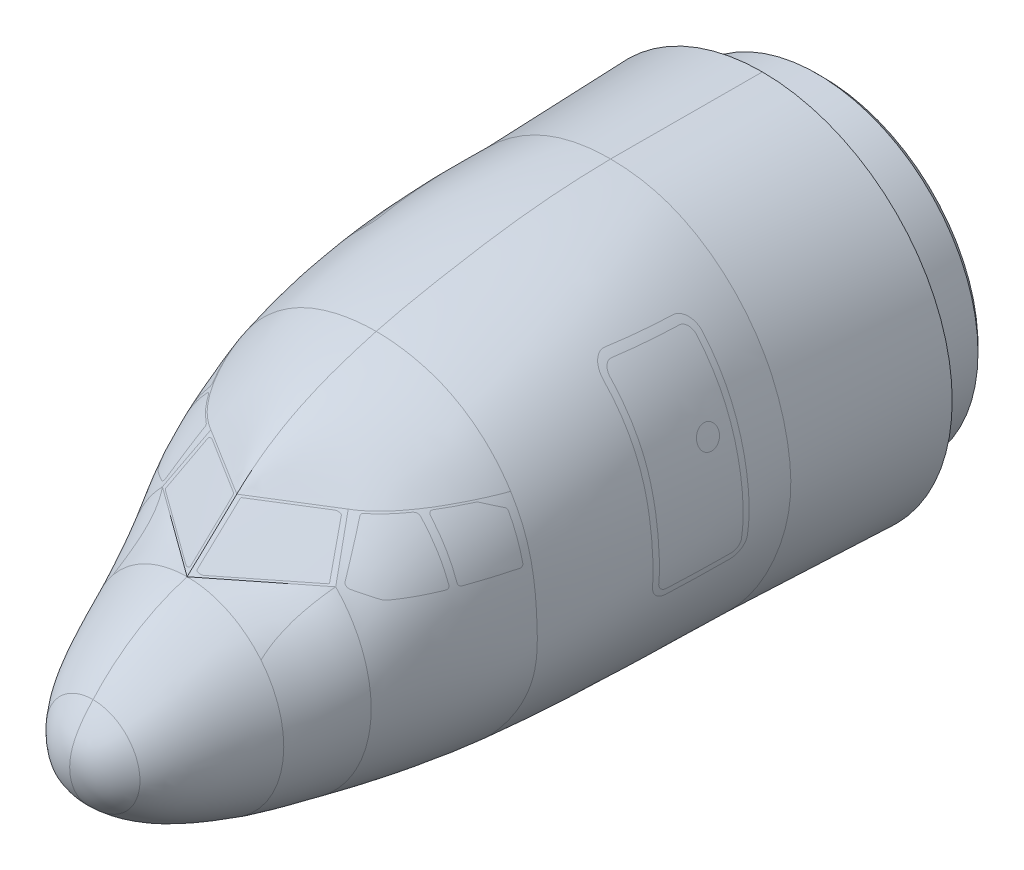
SolidWorks part; units mm, degrees
ref_plane "Plan de face" through (0, 0, 0) normal (0, 0, 1) x (1, 0, 0)
ref_plane "Plan de dessus" through (0, 0, 0) normal (0, 1, 0) x (1, 0, 0)
ref_plane "Plan de droite" through (0, 0, 0) normal (1, 0, 0) x (0, 0, -1)
imported_body "Importée1"
scale "Echelle1"
ref_plane "Plan1" through (0, 0, -45.625) normal (0, 0, -1) x (-1, 0, 0)
sketch "Esquisse1" plane through (0, 0, -35.625) normal (0, 0, -1) x (-1, 0, 0)
  spline S2 degree 3 poles (-627.1798, 2924.8183) (-59.9591, 38.7146) (-23.2962, -13.9617) (2.7538, -7.8013) (3.1383, -7.6959) (3.9006, -7.45) (4.2762, -7.3101) (5.366, -6.8333) (6.0457, -6.4313) (6.9995, -5.7104) (7.3075, -5.4498) (7.8894, -4.904) (8.1652, -4.6176) (8.6889, -4.0198) (8.9368, -3.7085) (9.4061, -3.0622) (9.6278, -2.7265) (10.2451, -1.7017) (10.5977, -0.9899) (11.1976, 0.4844) (11.4467, 1.2518) (11.7873, 2.8007) (11.8783, 3.5874) (11.8689, 4.7896) (11.8434, 5.1913) (11.7557, 5.9839) (11.6933, 6.3768) (11.5372, 7.157) (11.4434, 7.5443) (11.2224, 8.3127) (11.0948, 8.6948) (10.6669, 9.8116) (10.319, 10.5228) (9.6977, 11.5366) (9.4742, 11.8658) (8.9934, 12.5062) (8.7367, 12.8162) (7.9323, 13.6982) (7.346, 14.2298) (6.3883, 14.9391) (6.0551, 15.1612) (5.3639, 15.5712) (5.011, 15.7561) (3.9296, 16.2494) (3.1776, 16.4936) (2.0026, 16.7317) (1.6027, 16.7903) (-55.1553, 22.2186) (-141.8735, -367.5838) (61.0488, 3012.8504) knots -2.009397 -2.009397 -2.009397 -2.009397 0.0625 0.0625 0.09375 0.09375 0.125 0.125 0.1875 0.1875 0.21875 0.21875 0.25 0.25 0.28125 0.28125 0.3125 0.3125 0.375 0.375 0.4375 0.4375 0.5 0.5 0.53125 0.53125 0.5625 0.5625 0.59375 0.59375 0.625 0.625 0.6875 0.6875 0.71875 0.71875 0.75 0.75 0.8125 0.8125 0.84375 0.84375 0.875 0.875 0.9375 0.9375 0.96875 0.96875 5.376639 5.376639 5.376639 5.376639 only from (0, -8.2055) to (0, 16.885)
  spline S3 degree 3 poles (-301.0809, 2998.3208) (177.8937, -393.4364) (53.5442, 27.8643) (-2.7603, 16.579) (-3.1459, 16.4799) (-3.9094, 16.2338) (-4.2836, 16.0877) (-5.3686, 15.5935) (-6.0501, 15.1881) (-7.0149, 14.4757) (-7.3264, 14.2205) (-7.9175, 13.6862) (-8.1988, 13.4058) (-8.734, 12.8192) (-8.9878, 12.5131) (-9.4678, 11.8749) (-9.6944, 11.5418) (-10.3196, 10.5223) (-10.6673, 9.8102) (-11.236, 8.3266) (-11.4582, 7.5505) (-11.7703, 5.9939) (-11.8639, 5.2081) (-11.8758, 4.0139) (-11.8565, 3.6101) (-11.7696, 2.8138) (-11.7036, 2.4214) (-11.4488, 1.259) (-11.2044, 0.5032) (-10.7532, -0.6088) (-10.5885, -0.9748) (-10.2337, -1.6881) (-10.043, -2.0366) (-9.6339, -2.7169) (-9.4154, -3.0485) (-8.9483, -3.6935) (-8.6987, -4.0081) (-7.9075, -4.9129) (-7.3302, -5.4587) (-6.3798, -6.1797) (-6.0475, -6.4043) (-5.3556, -6.8129) (-5.0003, -6.9934) (-3.9093, -7.4704) (-3.1502, -7.7073) (23.8326, -14.0951) (58.4146, 42.4045) (465.7415, 2954.7742) knots -4.430432 -4.430432 -4.430432 -4.430432 0.0625 0.0625 0.09375 0.09375 0.125 0.125 0.1875 0.1875 0.21875 0.21875 0.25 0.25 0.28125 0.28125 0.3125 0.3125 0.375 0.375 0.4375 0.4375 0.5 0.5 0.53125 0.53125 0.5625 0.5625 0.625 0.625 0.65625 0.65625 0.6875 0.6875 0.71875 0.71875 0.75 0.75 0.8125 0.8125 0.84375 0.84375 0.875 0.875 0.9375 0.9375 3.038245 3.038245 3.038245 3.038245 only from (0, 16.885) to (0, -8.2055)
  spline S4 degree 3 poles (0, -8.2055) (0.8084, -8.2055) (1.5926, -8.0759) (2.7538, -7.8013) (3.1383, -7.6959) (3.9006, -7.45) (4.2762, -7.3101) (5.366, -6.8333) (6.0457, -6.4313) (6.9995, -5.7104) (7.3075, -5.4498) (7.8894, -4.904) (8.1652, -4.6176) (8.6889, -4.0198) (8.9368, -3.7085) (9.4061, -3.0622) (9.6278, -2.7265) (10.2451, -1.7017) (10.5977, -0.9899) (11.1976, 0.4844) (11.4467, 1.2518) (11.7873, 2.8007) (11.8783, 3.5874) (11.8689, 4.7896) (11.8434, 5.1913) (11.7557, 5.9839) (11.6933, 6.3768) (11.5372, 7.157) (11.4434, 7.5443) (11.2224, 8.3127) (11.0948, 8.6948) (10.6669, 9.8116) (10.319, 10.5228) (9.6977, 11.5366) (9.4742, 11.8658) (8.9934, 12.5062) (8.7367, 12.8162) (7.9323, 13.6982) (7.346, 14.2298) (6.3883, 14.9391) (6.0551, 15.1612) (5.3639, 15.5712) (5.011, 15.7561) (3.9296, 16.2494) (3.1776, 16.4936) (2.0026, 16.7317) (1.6027, 16.7903) (0.8036, 16.8667) (0.4025, 16.885) (0, 16.885) knots 0 0 0 0 0.0625 0.0625 0.09375 0.09375 0.125 0.125 0.1875 0.1875 0.21875 0.21875 0.25 0.25 0.28125 0.28125 0.3125 0.3125 0.375 0.375 0.4375 0.4375 0.5 0.5 0.53125 0.53125 0.5625 0.5625 0.59375 0.59375 0.625 0.625 0.6875 0.6875 0.71875 0.71875 0.75 0.75 0.8125 0.8125 0.84375 0.84375 0.875 0.875 0.9375 0.9375 0.96875 0.96875 1 1 1 1
  spline S5 degree 3 poles (0, 16.885) (-0.8025, 16.8851) (-1.5936, 16.8129) (-2.7603, 16.579) (-3.1459, 16.4799) (-3.9094, 16.2338) (-4.2836, 16.0877) (-5.3686, 15.5935) (-6.0501, 15.1881) (-7.0149, 14.4757) (-7.3264, 14.2205) (-7.9175, 13.6862) (-8.1988, 13.4058) (-8.734, 12.8192) (-8.9878, 12.5131) (-9.4678, 11.8749) (-9.6944, 11.5418) (-10.3196, 10.5223) (-10.6673, 9.8102) (-11.236, 8.3266) (-11.4582, 7.5505) (-11.7703, 5.9939) (-11.8639, 5.2081) (-11.8758, 4.0139) (-11.8565, 3.6101) (-11.7696, 2.8138) (-11.7036, 2.4214) (-11.4488, 1.259) (-11.2044, 0.5032) (-10.7532, -0.6088) (-10.5885, -0.9748) (-10.2337, -1.6881) (-10.043, -2.0366) (-9.6339, -2.7169) (-9.4154, -3.0485) (-8.9483, -3.6935) (-8.6987, -4.0081) (-7.9075, -4.9129) (-7.3302, -5.4587) (-6.3798, -6.1797) (-6.0475, -6.4043) (-5.3556, -6.8129) (-5.0003, -6.9934) (-3.9093, -7.4704) (-3.1502, -7.7073) (-1.591, -8.0764) (-0.804, -8.2055) (0, -8.2055) knots 0 0 0 0 0.0625 0.0625 0.09375 0.09375 0.125 0.125 0.1875 0.1875 0.21875 0.21875 0.25 0.25 0.28125 0.28125 0.3125 0.3125 0.375 0.375 0.4375 0.4375 0.5 0.5 0.53125 0.53125 0.5625 0.5625 0.625 0.625 0.65625 0.65625 0.6875 0.6875 0.71875 0.71875 0.75 0.75 0.8125 0.8125 0.84375 0.84375 0.875 0.875 0.9375 0.9375 1 1 1 1
  dimension "D1" = 0
sketch "Esquisse2" plane through (0, 0, -45.625) normal (0, 0, -1) x (-1, 0, 0)
  circle A0 centre (0, 4.35) radius 12.5
  point P0 (0, 4.35)
  dimension "D1" = 25
loft "Lissage1" add profiles "Esquisse2", "Esquisse1"
sketch "Esquisse3" plane through (0, 0, -45.625) normal (0, 0, -1) x (-1, 0, 0)
  circle A0 centre (0, 4.35) radius 10.6
  arc A1 (-0.0001, 16.85) -> (-0.0001, -8.15) centre (0, 4.35) ccw construction
  dimension "D1" = 21.2
extrude "Boss.-Extru.1" add sketch "Esquisse3" along normal blind 4
scale "Echelle2" scale about centroid uniform scaling yes scale factor 1.25
fillet "Congé1" radius 0.2 1 edges at (-13.25, 4.4923, -49.5057)
chamfer "Chanfrein1" distance 0.5 angle 45 1 edges at (-13.25, 4.4923, -54.5057)
hole_wizard "Diamètre du perçage Ø4.0 (4)1" positions "Esquisse6" profile "Esquisse5" hole size "Ø4.0" standard "Ansi Metric"
sketch "Esquisse6" plane through (0, 0, -54.5057) normal (0, 0, -1) x (-1, 0, 0)
  circle A0 centre (0, 4.4923) radius 13.25 construction
  point P0 (0, 11.9923)
  dimension "D1" = 7.5
sketch "Esquisse5" plane through (0, 11.9923, -54.5057) normal (1, 0, 0) x (0, 1, 0)
  line L0 (0, 0) -> (0, 7.2017)
  line L1 (0, 7.2017) -> (2, 6)
  line L2 (2, 6) -> (2, 0)
  line L5 (2, 0) -> (0, 0)
  line L10 (0, 7.2017) -> (-2, 6) construction
  line L11 (0, -6.35) -> (0, 107.95) construction
  dimension "Diamètre du perçage" = 4
  dimension "Profondeur du perçage" = 6
  dimension "Angle de pointe" = 118
